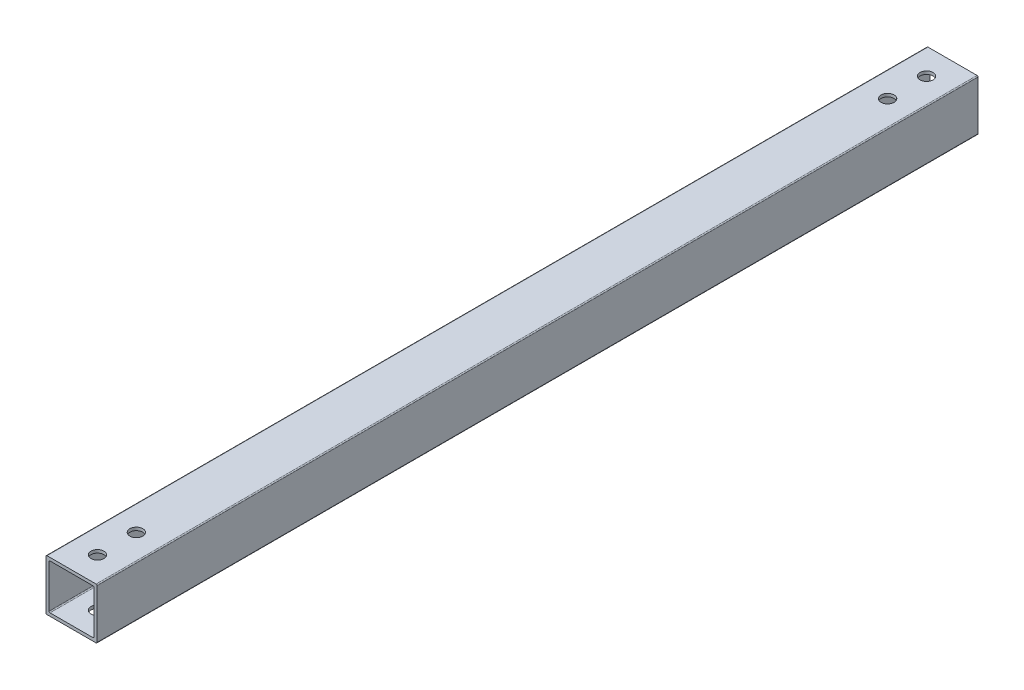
SolidWorks part; units mm, degrees
ref_plane "Front Plane" through (0, 0, 0) normal (0, 0, 1) x (1, 0, 0)
ref_plane "Top Plane" through (0, 0, 0) normal (0, 1, 0) x (1, 0, 0)
ref_plane "Right Plane" through (0, 0, 0) normal (1, 0, 0) x (0, 0, -1)
ref_plane "Plane1" through (0, 0, -2000) normal (0, 0, -1) x (-1, 0, 0)
sketch "Sketch1" plane through (0, 0, -2000) normal (0, 0, -1) x (-1, 0, 0)
  line L0 (11, 10.5) -> (11, -10.5)
  line L1 (10.5, -11) -> (-10.5, -11)
  line L2 (-11, -10.5) -> (-11, 10.5)
  line L3 (-10.5, 11) -> (10.5, 11)
  line L4 (12.5, -12) -> (12.5, 12)
  line L5 (12, 12.5) -> (-12, 12.5)
  line L6 (-12.5, 12) -> (-12.5, -12)
  line L7 (-12, -12.5) -> (12, -12.5)
  line L8 (0, 12.5) -> (0, -12.5) construction
  line L9 (-12.5, 0) -> (12.5, 0) construction
  arc A0 (11, -10.5) -> (10.5, -11) centre (10.5, -10.5) cw
  arc A1 (-10.5, -11) -> (-11, -10.5) centre (-10.5, -10.5) cw
  arc A2 (-11, 10.5) -> (-10.5, 11) centre (-10.5, 10.5) cw
  arc A3 (10.5, 11) -> (11, 10.5) centre (10.5, 10.5) cw
  arc A4 (12.5, 12) -> (12, 12.5) centre (12, 12) ccw
  arc A5 (-12, 12.5) -> (-12.5, 12) centre (-12, 12) ccw
  arc A6 (-12.5, -12) -> (-12, -12.5) centre (-12, -12) ccw
  arc A7 (12, -12.5) -> (12.5, -12) centre (12, -12) ccw
  dimension "D7" = 0.5
  dimension "D8" = 0.5
  dimension "D9" = 0.5
  dimension "D10" = 0.5
  dimension "D11" = 0.5
  dimension "D1" = 25
  dimension "D2" = 25
  dimension "D3" = 1.5
  dimension "D4" = 1.5
  dimension "D5" = 1.5
  dimension "D6" = 1.5
extrude "Boss-Extrude1" add sketch "Sketch1" against normal blind 431.4
sketch "Sketch2" plane through (0, 12.5, 0) normal (0, 1, 0) x (1, 0, 0)
  line L0 (-12, 1784.3) -> (12, 1784.3) construction
  line L1 (-12, 1568.6) -> (-12, 2000) construction
  line L2 (12, 1568.6) -> (12, 2000) construction
  line L3 (0, 2000) -> (0, 1568.6) construction
  line L4 (-12, 2000) -> (12, 2000) construction
  line L5 (-12, 1568.6) -> (12, 1568.6) construction
  circle A0 centre (0, 1987.3) radius 3.175
  circle A1 centre (0, 1968.25) radius 3.175
  circle A2 centre (0, 1600.35) radius 3.175
  circle A3 centre (0, 1581.3) radius 3.175
  dimension "D3" = 6.35
  dimension "D4" = 6.35
  dimension "D1" = 12.7
  dimension "D2" = 31.75
extrude "Cut-Extrude1" cut sketch "Sketch2" against normal up to surface (25 mm away)
